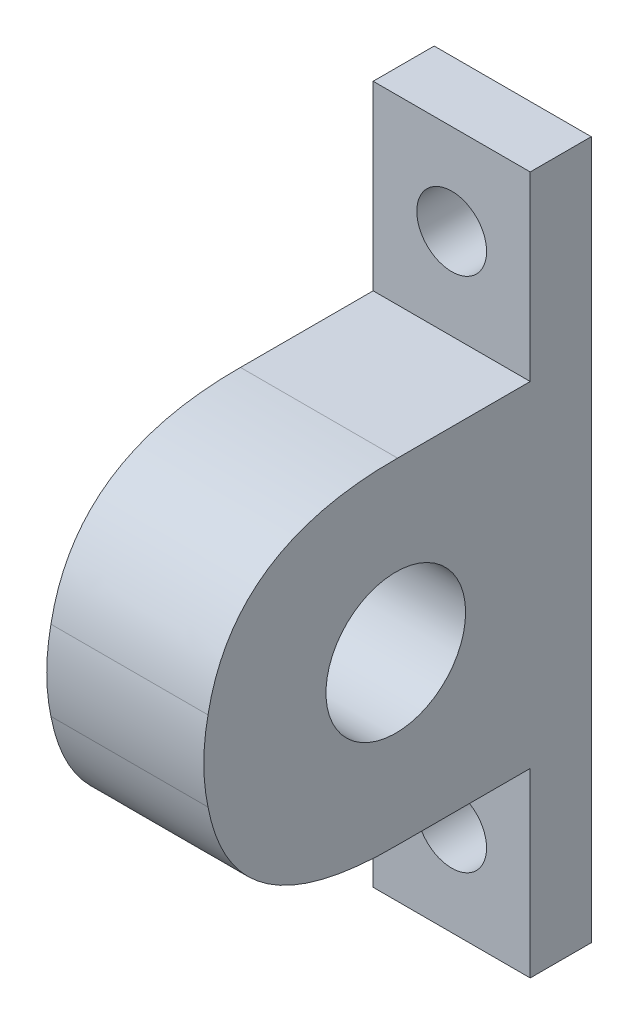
SolidWorks part; units mm, degrees
ref_plane "Front Plane" through (0, 0, 0) normal (1, 0, 0) x (0, 1, 0)
ref_plane "Top Plane" through (0, 0, 0) normal (0, 0, 1) x (0, 1, 0)
ref_plane "Right Plane" through (0, 0, 0) normal (0, 1, 0) x (-1, 0, 0)
sketch "Sketch1" plane through (0, 0, 0) normal (0, 0, 1) x (0, 1, 0)
  line L0 (-50, 0) -> (50, 0)
  line L1 (-50, 0) -> (-50, -22.5)
  line L2 (-50, -22.5) -> (50, -22.5)
  line L3 (50, -22.5) -> (50, 0)
  point P4 (0, 0)
  dimension "D1" = 100
  dimension "D2" = 22.5
extrude "Boss-Extrude1" add sketch "Sketch1" along normal blind 55.5
sketch "Sketch2" plane through (22.5, 0, 0) normal (1, 0, 0) x (0, 1, 0)
  line L0 (0, 0) -> (0, 0.5)
  line L1 (-24, 0) -> (-24, 55.5)
  line L2 (-50, 0) -> (50, 0) construction
  line L4 (-50, 55.5) -> (-50, 0) construction
  line L5 (50, 55.5) -> (50, 0) construction
  line L6 (19.6311, 8.742) -> (50, 8.742)
  line L8 (50, 55.5) -> (50, 14.5743)
  line L10 (-50, 55.5) -> (50, 55.5) construction
  line L12 (24, 0) -> (24, 55.5)
  line L13 (0, 0.5) -> (0, 55.5)
  line L14 (-24, 8.742) -> (-19.6311, 8.742)
  line L15 (-24, 8.742) -> (-50, 8.742)
  circle A4 centre (0, 28) radius 27.5
  circle A5 centre (0, 28) radius 10
  spline S0 degree 2 poles (0, 55.5) (-24.2004, 54.7772) (-24, 27.75) knots 0 0 0 1 1 1
  spline S1 degree 2 poles (0, 55.5) (24.2004, 54.7772) (24, 27.75) knots 0 0 0 1 1 1
  dimension "D2" = 20
  dimension "D1" = 0.5
extrude "Cut-Extrude1" cut sketch "Sketch2" against normal through all contours A4 L1 L15 M8 M9 | S0 L1 A4 | S0 A4 L1 | S0 A4 L1 M8 | L13 A5 | L13 A5 | A4 S1 L12 M8 | A4 L12 L6 M7 M8 | L12 S1 A4 | A4 S1 L12
sketch "Sketch3" plane through (0, 0, 8.742) normal (0, 0, 1) x (1, 0, 0)
  line L0 (22.5, 50) -> (0, 24)
  circle A0 centre (11.25, 37) radius 5
  dimension "D1" = 10
extrude "Cut-Extrude2" cut sketch "Sketch3" against normal through all contours L0 A0 | L0 A0
sketch "Sketch5" plane through (0, 0, 8.742) normal (0, 0, 1) x (1, 0, 0)
  line L0 (0, -24) -> (22.5, -50)
  circle A0 centre (11.25, -37) radius 4.9984
extrude "Cut-Extrude3" cut sketch "Sketch5" against normal through all contours L0 A0 | L0 A0
sketch "Sketch6" plane through (0, 0, 0) normal (-1, 0, 0) x (0, -1, 0)
  circle A0 centre (0, 28) radius 12
  dimension "D1" = 24
extrude "Boss-Extrude2" add sketch "Sketch6" along normal blind 5 contours A0 M1
